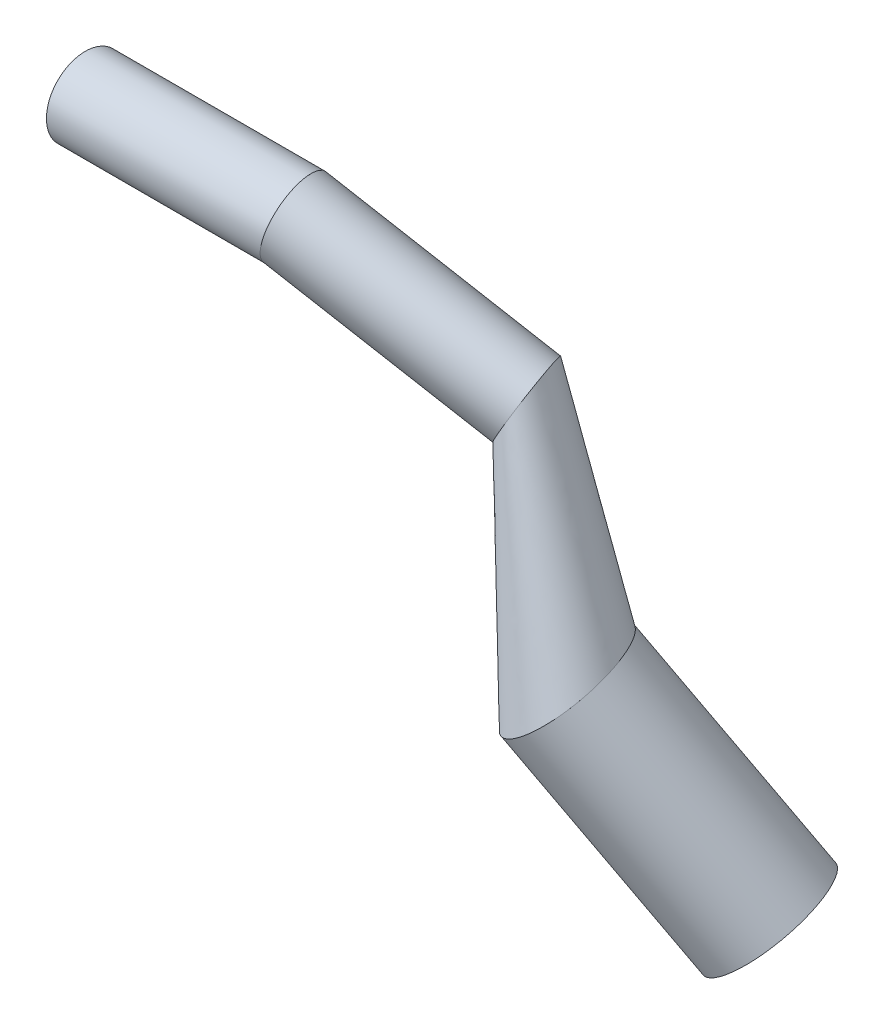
SolidWorks part; units mm, degrees
ref_plane "Ebene vorne" through (0, 0, 0) normal (0, 0, 1) x (1, 0, 0)
ref_plane "Ebene oben" through (0, 0, 0) normal (0, 1, 0) x (1, 0, 0)
ref_plane "Ebene rechts" through (0, 0, 0) normal (1, 0, 0) x (0, 0, -1)
sketch3d "3D-Skizze1"
  line L0 (0, 0, 0) -> (57.4151, 0, 0)
  line L1 (57.4151, 0, 0) -> (105.1582, -27.3946, -15.9377)
  line L2 (105.1582, -27.3946, -15.9377) -> (122.5565, -82.2974, -9.6841)
  line L3 (122.5565, -82.2974, -9.6841) -> (159.2105, -130.1386, -28.4962)
ref_plane "Ebene1" through (0, 0, 0) normal (1, 0, 0) x (0, 0, -1)
other "Strukturbauteil1"
ref_plane "Ebene2" through (0, 0, 0) normal (1, 0, 0) x (0, 0, -1)
sketch "Sketch11" plane through (0, 0, 0) normal (1, 0, 0) x (0, 0, -1)
  circle A0 centre (0, 0) radius 8.35
  circle A1 centre (0, 0) radius 10.65
  point P3 (0, 0)
  dimension "In_dia" = 16.7
  dimension "Out_dia" = 21.3
other "Strukturbauteil2"
ref_plane "Ebene3" through (122.5565, -82.2974, -9.6841) normal (0.5806, -0.7577, -0.298) x (0.8142, 0.5403, 0.2125)
sketch "Sketch12" plane through (122.5565, -82.2974, -9.6841) normal (0.5806, -0.7577, -0.298) x (0.8142, 0.5403, 0.2125)
  circle A0 centre (0, 0) radius 12.85
  circle A1 centre (0, 0) radius 16.85
  point P3 (0, 0)
  dimension "In_dia" = 25.7
  dimension "Out_dia" = 33.7
sketch "Skizze5" plane through (79.1855, -103.3537, -40.6408) normal (-0.5806, 0.7577, 0.298) x (0.8142, 0.5403, 0.2125)
  circle A0 centre (53.2667, -21.104) radius 12.85 construction
  circle A1 centre (53.2667, -21.104) radius 16.85
  circle A2 centre (53.2667, -21.104) radius 16.85
  circle A3 centre (53.2667, -21.104) radius 12.85
  dimension "D1" = 0
sketch "Skizze6" plane through (87.596, -50.2619, -29.2415) normal (0.8331, -0.478, -0.2781) x (-0.2412, 0.1384, -0.9605)
  circle A0 centre (-13.8502, 28.5745) radius 8.35 construction
  circle A1 centre (-13.8502, 28.5745) radius 10.65
  circle A2 centre (-13.8502, 28.5745) radius 10.65
  circle A3 centre (-13.8502, 28.5745) radius 8.35
  dimension "D1" = 0
loft "Ausformung1" add
equation "\"LÄNGE\"=0"
equation "\"BREITE\"=0"
equation "\"HÖHE\"=0"
equation "\"DURCHMESSER\"=0"
equation "\"Stückzahl\"= 1"
